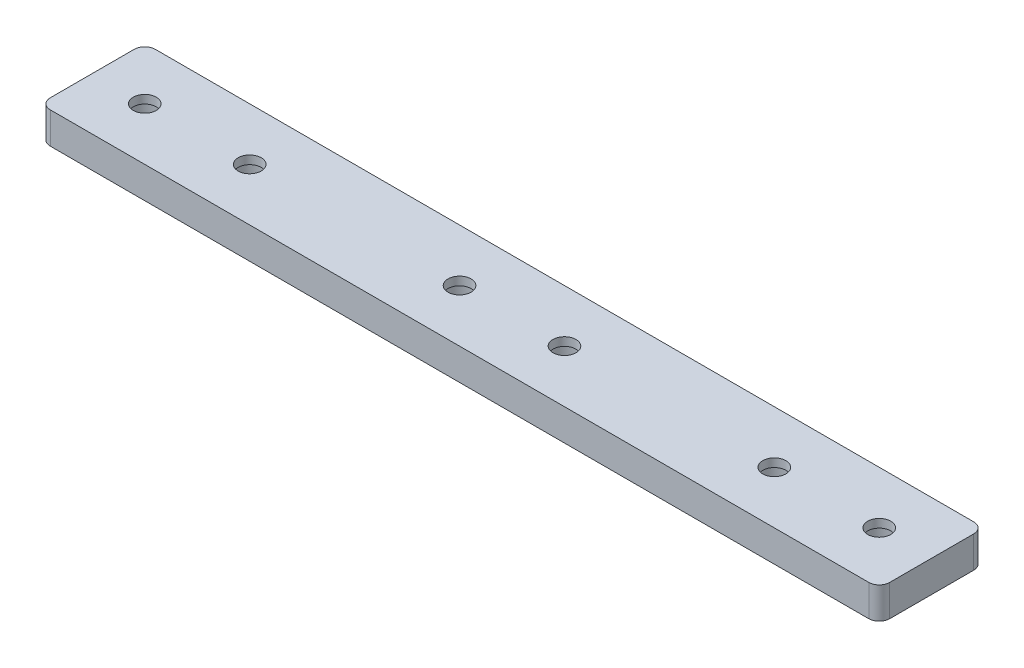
SolidWorks part; units mm, degrees
ref_plane "Alzado" through (0, 0, 0) normal (0, 0, 1) x (1, 0, 0)
ref_plane "Planta" through (0, 0, 0) normal (0, 1, 0) x (1, 0, 0)
ref_plane "Vista lateral" through (0, 0, 0) normal (1, 0, 0) x (0, 0, -1)
sketch "Croquis1" plane through (0, 0, 0) normal (0, 1, 0) x (1, 0, 0)
  line L1 (-195, 25) -> (195, 25)
  line L2 (-200, 20) -> (-200, -20)
  line L3 (-195, -25) -> (195, -25)
  line L4 (200, 20) -> (200, -20)
  arc A0 (200, 20) -> (195, 25) centre (195, 20) ccw
  arc A1 (200, -20) -> (195, -25) centre (195, -20) cw
  arc A2 (-200, -20) -> (-195, -25) centre (-195, -20) ccw
  arc A3 (-200, 20) -> (-195, 25) centre (-195, 20) cw
  point P7 (200, 25)
  point P12 (-200, -25)
  point P15 (-200, 25)
  dimension "D5" = 5
  dimension "D1" = 400
  dimension "D2" = 50
  dimension "D3" = 25
  dimension "D4" = 200
extrude "Extruir1" add sketch "Croquis1" along normal blind 15
hole_wizard "Refrentado para tornillo de cabeza cilíndrica con ranura de M10-2" positions "Croquis3D1" profile "Croquis7" counterbore size "M10" standard "DIN"
sketch3d "Croquis3D1"
  line L0 (-200, 0, -20) -> (-200, 0, 20) construction
  line L1 (200, 0, 20) -> (200, 0, -20) construction
  line L2 (195, 0, -25) -> (-195, 0, -25) construction
  point P0 (-175, 0, 0)
  point P2 (-125, 0, 0)
  point P4 (-25, 0, 0)
  point P6 (25, 0, 0)
  point P8 (175, 0, 0)
  point P10 (125, 0, 0)
  dimension "D1" = 50
  dimension "D2" = 25
  dimension "D3" = 25
  dimension "D4" = 50
  dimension "D5" = 100
  dimension "D6" = 50
  dimension "D7" = 25
  dimension "D8" = 25
  dimension "D9" = 25
  dimension "D10" = 25
  dimension "D11" = 25
  dimension "D12" = 25
sketch "Croquis7" plane through (-175, 0, 0) normal (1, 0, 0) x (0, 0, -1)
  line L0 (0, 0) -> (0, 15)
  line L1 (0, 15) -> (5.5, 15)
  line L3 (5.5, 15) -> (5.5, 11)
  line L4 (5.5, 11) -> (9, 11)
  line L5 (9, 11) -> (9, 0)
  line L7 (9, 0) -> (0, 0)
  line L11 (0, -6.35) -> (0, 107.95) construction
  dimension "Diámetro de taladro hasta el siguiente" = 11
  dimension "Profundidad de taladro hasta el siguiente" = 15
  dimension "Diámetro de refrentado" = 18
  dimension "Profundidad de refrentado" = 11
